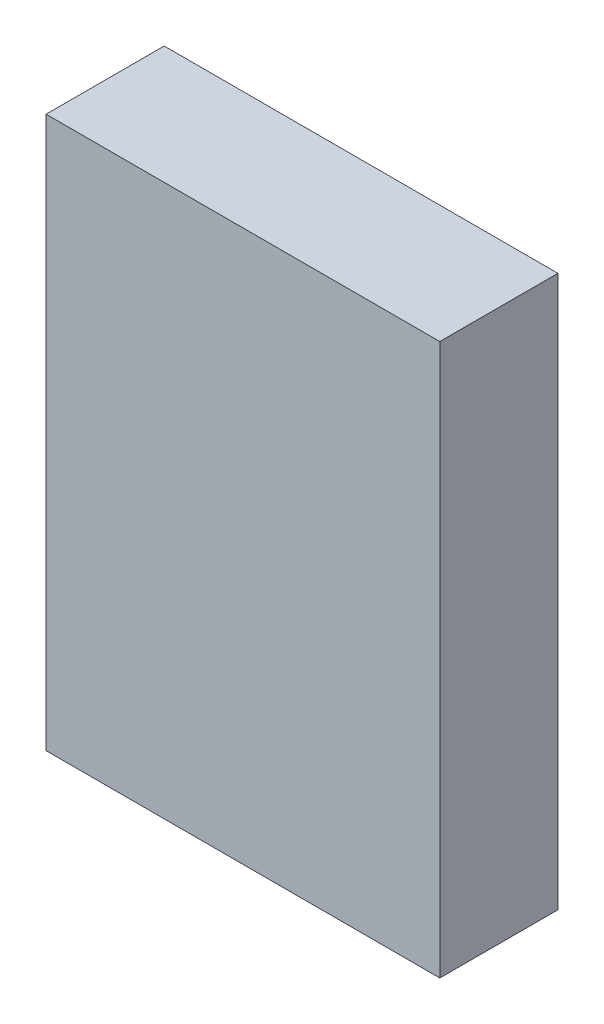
SolidWorks part; units mm, degrees
ref_plane "Спереди" through (0, 0, 0) normal (0, 0, 1) x (1, 0, 0)
ref_plane "Сверху" through (0, 0, 0) normal (0, 1, 0) x (1, 0, 0)
ref_plane "Справа" through (0, 0, 0) normal (1, 0, 0) x (0, 0, -1)
sketch "Эскиз1" plane through (0, 0, 0) normal (0, 1, 0) x (1, 0, 0)
  line L1 (-10, 3) -> (10, 3)
  line L2 (-10, 3) -> (-10, -3)
  line L3 (-10, -3) -> (10, -3)
  line L4 (10, 3) -> (10, -3)
  line L5 (-10, 3) -> (10, -3) construction
  line L6 (-10, -3) -> (10, 3) construction
  point P0 (0, 0)
  dimension "D1" = 6
  dimension "D2" = 20
extrude "Бобышка-Вытянуть1" add sketch "Эскиз1" along normal blind 28
sketch "Эскиз2" plane through (0, 0, 0) normal (0, -1, 0) x (1, 0, 0)
  line L1 (-5, 0.75) -> (5, 0.75)
  line L2 (-5, 0.75) -> (-5, -0.75)
  line L3 (-5, -0.75) -> (5, -0.75)
  line L4 (5, 0.75) -> (5, -0.75)
  line L5 (-5, 0.75) -> (5, -0.75) construction
  line L6 (-5, -0.75) -> (5, 0.75) construction
  point P0 (0, 0)
  dimension "D1" = 10
  dimension "D2" = 1.5
extrude "Вырез-Вытянуть1" cut sketch "Эскиз2" against normal blind 25
